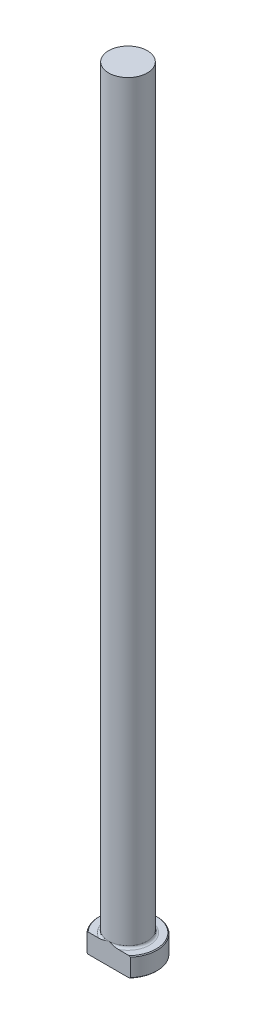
SolidWorks part; units mm, degrees
ref_plane "Front Plane" through (0, 0, 0) normal (0, 0, 1) x (1, 0, 0)
ref_plane "Top Plane" through (0, 0, 0) normal (0, 1, 0) x (1, 0, 0)
ref_plane "Right Plane" through (0, 0, 0) normal (1, 0, 0) x (0, 0, -1)
sketch "Sketch1" plane through (0, 0, 0) normal (0, 0, 1) x (1, 0, 0)
  line L0 (0, 259.9588) -> (0, -15.1925) construction
  line L1 (0, 0) -> (-9.525, 0)
  line L2 (-9.525, 0) -> (-9.525, 6.35)
  line L3 (-9.525, 6.35) -> (-6.35, 6.35)
  line L4 (-6.35, 6.35) -> (-6.35, 254)
  line L5 (-6.35, 254) -> (0, 254)
  line L6 (0, 254) -> (0, 0)
  dimension "L" = 254
  dimension "H" = 19.05
  dimension "T" = 6.35
  dimension "D" = 12.7
revolve "Revolve1" add sketch "Sketch1" angle 360 about L0
chamfer "Chamfer1" distance 0.254 angle 45 2 edges at (0, 6.35, 9.525) (0, 0, 9.525)
fillet "Fillet1" radius 0.762 1 edges at (0, 6.35, 6.35)
sketch "Sketch2" plane through (0, 0, 0) normal (0, -1, 0) x (1, 0, 0)
  line L0 (-7.0995, 6.35) -> (7.0995, 6.35)
  arc A0 (7.0995, 6.35) -> (-7.0995, 6.35) centre (0, 0) ccw
  circle A1 centre (0, 0) radius 9.525 construction
  circle A3 centre (0, 0) radius 6.35 construction
extrude "KEY" cut sketch "Sketch2" against normal through all
sketch "Pocket Sketch" plane through (0, 0, 0) normal (0, 0, 1) x (1, 0, 0)
  line L0 (-9.9219, 0) -> (-9.9219, 6.3754)
  line L1 (-9.9219, 6.3754) -> (-7.5089, 6.3754)
  line L2 (-6.7469, 7.1374) -> (-6.7469, 22.225)
  line L3 (-6.7469, 22.225) -> (0, 22.225)
  line L4 (0, 22.225) -> (0, 0)
  line L5 (0, 0) -> (-9.9219, 0)
  line L6 (0, 12.6104) -> (0, -2.4989) construction
  line L7 (-9.525, 6.096) -> (-9.525, 0.254) construction
  line L8 (9.271, 6.35) -> (-9.271, 6.35) construction
  line L9 (-6.35, 254) -> (-6.35, 7.112) construction
  line L10 (-7.5089, 6.3754) -> (-6.7469, 7.1374)
  point P3 (-6.7469, 6.3754)
  dimension "D1" = 19.8437
  dimension "D2" = 0.3969
  dimension "D3" = 0.0254
  dimension "D4" = 0.3969
  dimension "D5" = 13.4937
  dimension "D6" = 22.225
